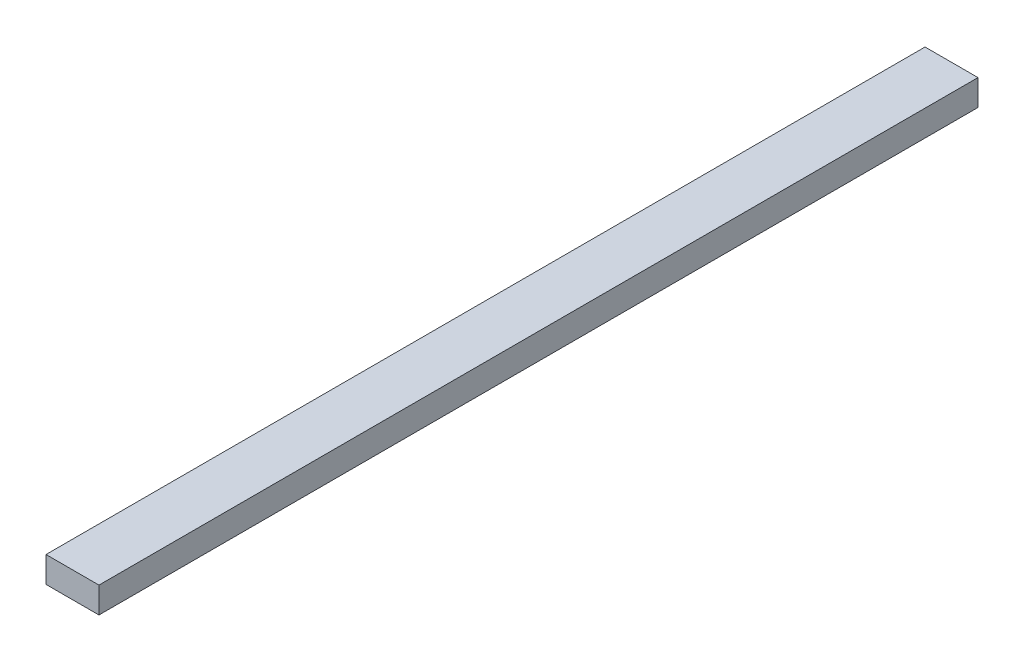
SolidWorks part; units mm, degrees
ref_plane "Plan de face" through (0, 0, 0) normal (0, 0, 1) x (1, 0, 0)
ref_plane "Plan de dessus" through (0, 0, 0) normal (0, 1, 0) x (1, 0, 0)
ref_plane "Plan de droite" through (0, 0, 0) normal (1, 0, 0) x (0, 0, -1)
sketch "Esquisse1" plane through (0, 0, 0) normal (0, 0, 1) x (1, 0, 0)
  line L1 (-23.5, 11.5) -> (23.5, 11.5)
  line L2 (-23.5, 11.5) -> (-23.5, -11.5)
  line L3 (-23.5, -11.5) -> (23.5, -11.5)
  line L4 (23.5, 11.5) -> (23.5, -11.5)
  line L5 (-23.5, 11.5) -> (23.5, -11.5) construction
  line L6 (-23.5, -11.5) -> (23.5, 11.5) construction
  point P0 (0, 0)
  dimension "D1" = 23
  dimension "D2" = 47
extrude "Boss.-Extru.1" add sketch "Esquisse1" along normal blind 780
